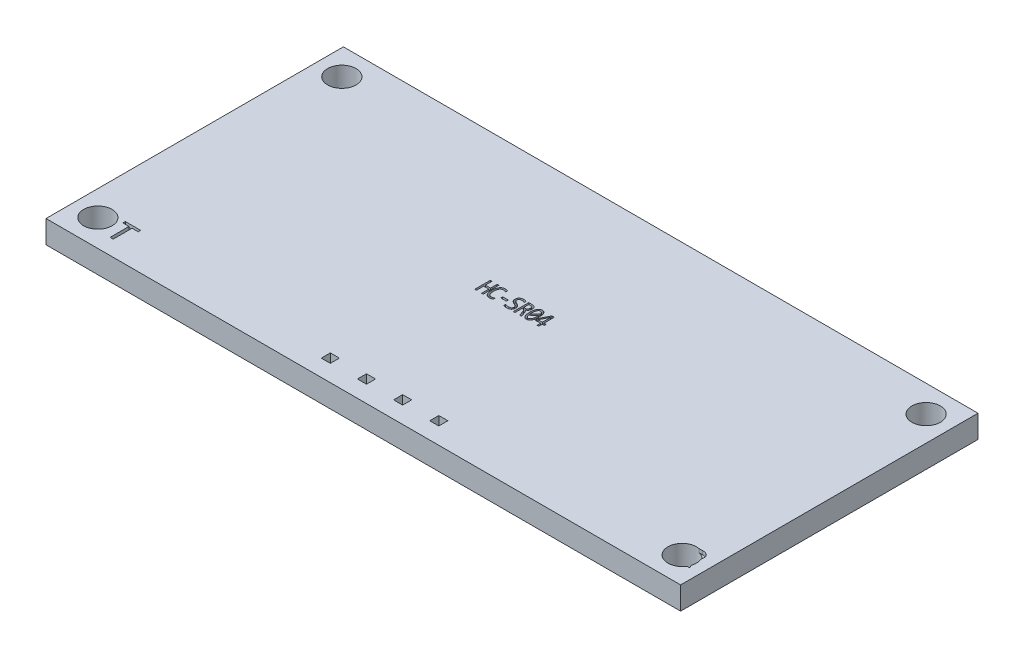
SolidWorks part; units mm, degrees
ref_plane "Alzado" through (0, 0, 0) normal (0, 0, 1) x (1, 0, 0)
ref_plane "Planta" through (0, 0, 0) normal (0, 1, 0) x (1, 0, 0)
ref_plane "Vista lateral" through (0, 0, 0) normal (1, 0, 0) x (0, 0, -1)
sketch "Croquis1" plane through (0, 0, 0) normal (0, 1, 0) x (1, 0, 0)
  line L0 (0, 0) -> (44.6, 0)
  line L1 (44.6, 0) -> (44.6, -20.9)
  line L2 (44.6, -20.9) -> (0, -20.9)
  line L3 (0, -20.9) -> (0, 0)
  line L4 (22.3, 0) -> (22.3, -20.9) construction
  line L5 (0, -10.45) -> (44.6, -10.45) construction
  circle A0 centre (1.7677, -1.8775) radius 1
  circle A1 centre (42.8323, -1.8775) radius 1
  circle A2 centre (42.8323, -19.0225) radius 1
  circle A3 centre (1.7677, -19.0225) radius 1
  dimension "D1" = 2
  dimension "D6" = 20.9
  dimension "D2" = 1.8775
  dimension "D3" = 1.7677
  dimension "D4" = 1.7677
  dimension "D5" = 1.8775
  dimension "D7" = 44.6
  dimension "D8" = 17.1451
extrude "Saliente-Extruir2" add sketch "Croquis1" along normal blind 1.6
ref_plane "Plano1" through (0, 2.3456, 0) normal (0, 1, 0) x (1, 0, 0)
sketch "Croquis3" plane through (0, 2.3456, 0) normal (0, 1, 0) x (1, 0, 0)
  text T0 "HC-SR04" font "Consolas" height 1.0884
extrude "Cortar-Extruir1" cut sketch "Croquis3" against normal blind 1
sketch "Croquis4" plane through (0, 2.3456, 0) normal (0, 1, 0) x (1, 0, 0)
  text T0 "R" font "Consolas" height 1.5
  text T1 "T" font "Consolas" height 1.5
extrude "Cortar-Extruir2" cut sketch "Croquis4" against normal blind 1
sketch "Croquis5"
  dimension "D1" = 0.9525
  dimension "D2" = 1.905
  dimension "D3" = 0.636
extrude "Cortar-Extruir4" cut sketch "Croquis5" against normal blind 10
